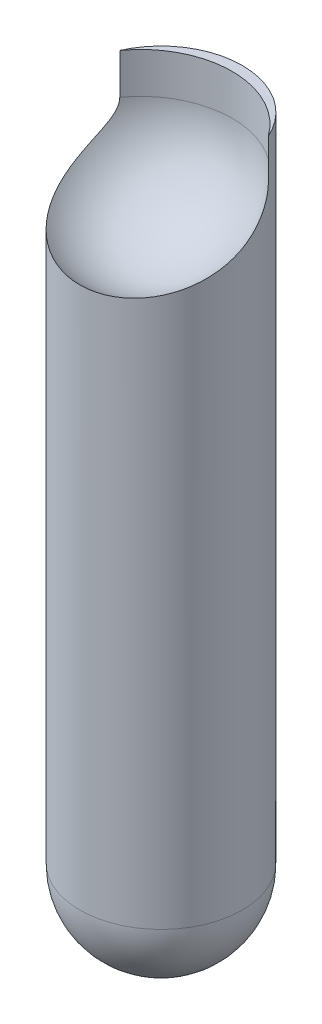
SolidWorks part; units mm, degrees
ref_plane "Front Plane" through (0, 0, 0) normal (0, 0, 1) x (1, 0, 0)
ref_plane "Top Plane" through (0, 0, 0) normal (0, 1, 0) x (1, 0, 0)
ref_plane "Right Plane" through (0, 0, 0) normal (1, 0, 0) x (0, 0, -1)
sketch "Sketch2" plane through (0, 0, 0) normal (0, 1, 0) x (1, 0, 0)
  circle A0 centre (0, 0) radius 50.8
  dimension "D1" = 101.6
extrude "Boss-Extrude1" add sketch "Sketch2" along normal blind 457.2
fillet "Fillet1" radius 50.8 1 edges at (0, 0, 50.8)
sketch "Sketch3" plane through (0, 0, 0) normal (-1, 0, 0) x (0, 0, 1)
  line L0 (-44.45, 431.8) -> (-44.45, 457.2)
  line L1 (50.8, 457.2) -> (-50.8, 457.2) construction
  line L2 (-44.45, 457.2) -> (12.7, 457.2)
  line L5 (12.7, 374.65) -> (12.7, 457.2)
  arc A0 (-44.45, 431.8) -> (12.7, 374.65) centre (12.7, 431.8) ccw
  dimension "D2" = 57.15
  dimension "D1" = 25.4
  dimension "D3" = 12.7
revolve "Cut-Revolve1" cut sketch "Sketch3" angle 360 about L5
